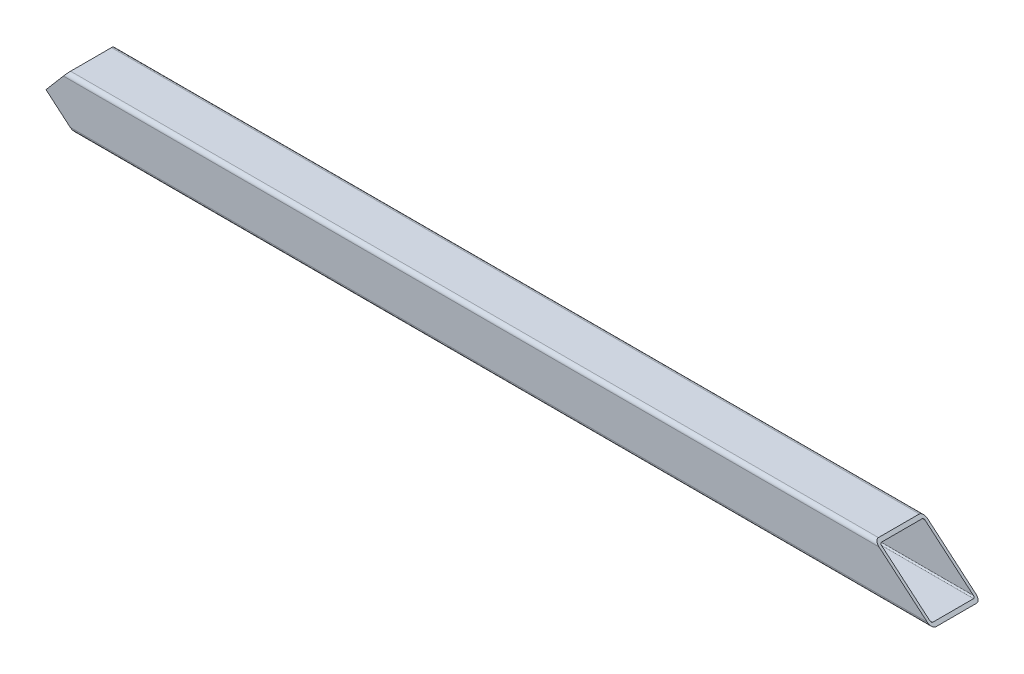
SolidWorks part; units mm, degrees
ref_plane "Front Plane" through (0, 0, 0) normal (0, 0, 1) x (1, 0, 0)
ref_plane "Top Plane" through (0, 0, 0) normal (0, 1, 0) x (1, 0, 0)
ref_plane "Right Plane" through (0, 0, 0) normal (1, 0, 0) x (0, 0, -1)
sketch "Sketch1" plane through (0, 0, 0) normal (1, 0, 0) x (0, 0, -1)
  line L0 (0, 2.54) -> (0, 29.21)
  line L1 (-2.54, 31.75) -> (-29.21, 31.75)
  line L2 (-31.75, 29.21) -> (-31.75, 2.54)
  line L3 (-29.21, 0) -> (-2.54, 0)
  line L4 (-1.651, 2.54) -> (-1.651, 29.21)
  line L5 (-2.54, 30.099) -> (-29.21, 30.099)
  line L6 (-30.099, 29.21) -> (-30.099, 2.54)
  line L7 (-29.21, 1.651) -> (-2.54, 1.651)
  arc A0 (-31.75, 2.54) -> (-29.21, 0) centre (-29.21, 2.54) ccw
  arc A1 (0, 2.54) -> (-2.54, 0) centre (-2.54, 2.54) cw
  arc A2 (0, 29.21) -> (-2.54, 31.75) centre (-2.54, 29.21) ccw
  arc A3 (-31.75, 29.21) -> (-29.21, 31.75) centre (-29.21, 29.21) cw
  arc A4 (-1.651, 29.21) -> (-2.54, 30.099) centre (-2.54, 29.21) ccw
  arc A5 (-30.099, 29.21) -> (-29.21, 30.099) centre (-29.21, 29.21) cw
  arc A6 (-30.099, 2.54) -> (-29.21, 1.651) centre (-29.21, 2.54) ccw
  arc A7 (-1.651, 2.54) -> (-2.54, 1.651) centre (-2.54, 2.54) cw
  point P12 (0, 0)
  point P15 (0, 31.75)
  point P18 (-31.75, 31.75)
  dimension "D3" = 2.54
  dimension "D1" = 31.75
  dimension "D2" = 31.75
  dimension "D4" = 1.651
extrude "Boss-Extrude1" add sketch "Sketch1" along normal blind 698.5
sketch "Sketch2" plane through (0, 0, 0) normal (-1, 0, 0) x (0, 0, 1)
  line L0 (0, 15.875) -> (31.75, 15.875)
  line L1 (0, 2.54) -> (0, 29.21) construction
  line L2 (31.75, 29.21) -> (31.75, 2.54) construction
sketch "Sketch3" plane through (0, 0, 31.75) normal (0, 0, 1) x (1, 0, 0)
sketch "Sketch5" plane through (0, 0, 31.75) normal (0, 0, 1) x (1, 0, 0)
  line L0 (583.843, -5.256) -> (527.3428, 42.7534)
  line L1 (527.3428, 42.7534) -> (627.8806, 161.0721)
  line L2 (627.8806, 161.0721) -> (762.2711, 46.8778)
  line L3 (762.2711, 46.8778) -> (661.7332, -71.4409)
  line L4 (661.7332, -71.4409) -> (583.843, -5.256)
  line L5 (0, 29.21) -> (0, 2.54) construction
  line L6 (698.5, 2.54) -> (0, 2.54) construction
  line L7 (20.6239, -1.6495) -> (0, 15.875)
  line L11 (-10.2795, 3.7775) -> (10.3444, -13.747)
  line L12 (10.3444, -13.747) -> (20.6239, -1.6495)
  line L13 (0, 15.875) -> (15.4842, 34.0977)
  line L14 (15.4842, 34.0977) -> (6.5925, 41.6531)
  line L15 (6.5925, 41.6531) -> (-8.8916, 23.4304)
  line L17 (-10.2795, 3.7775) -> (-8.8916, 23.4304)
  dimension "D1" = 6.5925
  dimension "D2" = 10.3444
  dimension "D3" = 15.4842
  dimension "D4" = 20.6239
  dimension "D5" = 527.3428
  dimension "D6" = 583.843
  dimension "D7" = 627.8806
  dimension "D8" = 661.7332
  dimension "D9" = 8.8916
  dimension "D10" = 1.2375
  dimension "D11" = 13.335
  dimension "D12" = 40.2134
extrude "Cut-Extrude4" cut sketch "Sketch5" against normal blind 38.1
